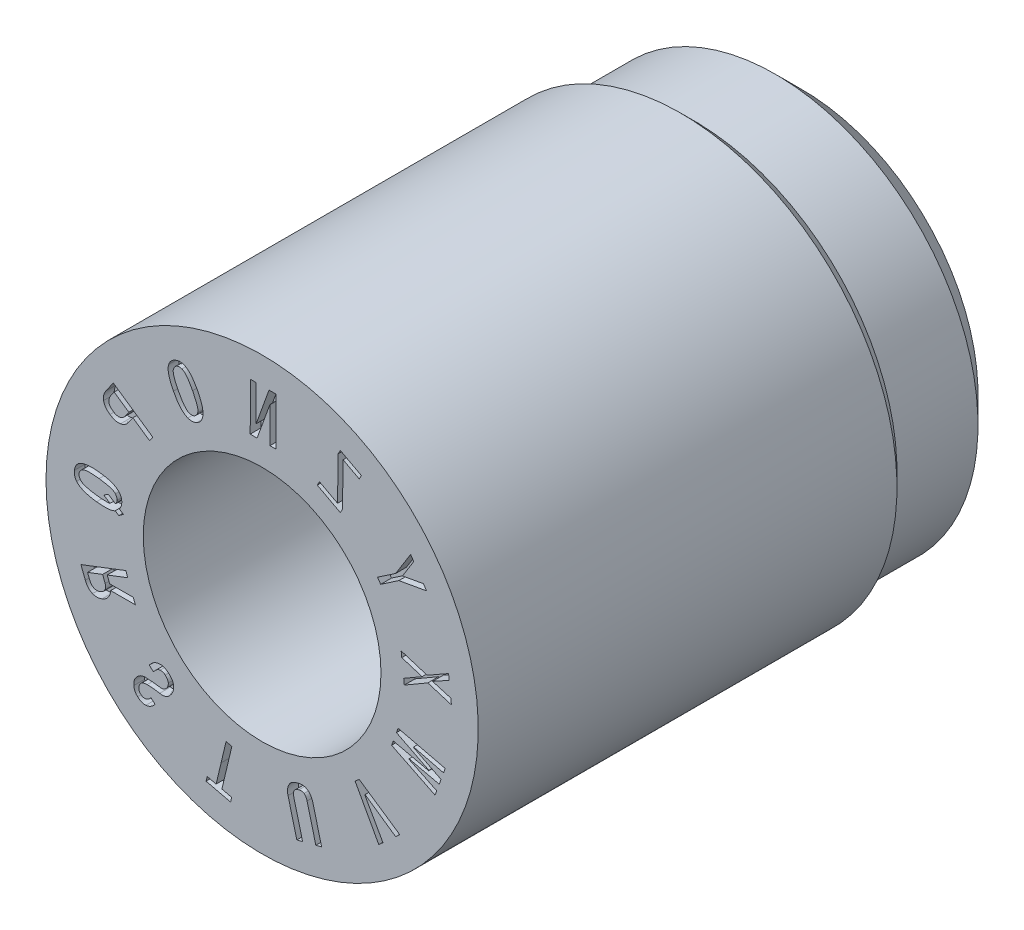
SolidWorks part; units mm, degrees
ref_plane "Front Plane" through (0, 0, 0) normal (0, 0, 1) x (1, 0, 0)
ref_plane "Top Plane" through (0, 0, 0) normal (0, 1, 0) x (1, 0, 0)
ref_plane "Right Plane" through (0, 0, 0) normal (1, 0, 0) x (0, 0, -1)
sketch "Sketch2" plane through (0, 0, 0) normal (0, 1, 0) x (1, 0, 0)
  line L0 (0, 4.8491) -> (0, -49995.1509) construction
  line L10 (3.2496, 10) -> (1.15, 10)
  line L11 (3.75, 9.4996) -> (3.2496, 10)
  line L12 (3.75, 8) -> (3.75, 9.4996)
  line L13 (4, 7.75) -> (3.75, 8)
  line L14 (4, 0) -> (4, 7.75)
  line L15 (2.2, 0) -> (4, 0)
  line L16 (2.2, 0) -> (2.2, 7.468)
  line L17 (1.15, 7.468) -> (2.2, 7.468)
  line L18 (1.15, 7.468) -> (1.15, 10)
  dimension "D1" = 8
  dimension "D2" = 4.4
  dimension "D3" = 2.532
  dimension "D4" = 2.3
  dimension "D5" = 7.5
  dimension "D6" = 10
  dimension "D7" = 45
  dimension "D8" = 45
  dimension "D9" = 2
  dimension "D10" = 0.5004
revolve "Revolve1" add sketch "Sketch2" angle 360 about L0
sketch "Sketch7" plane through (0, 0, 0) normal (0, 0, 1) x (1, 0, 0)
  line L0 (0, 0) -> (1.8589, 3.5418) construction
  line L1 (0, 0) -> (3.2919, 2.2723) construction
  line L2 (0, 0) -> (3.9708, 0.4821) construction
  line L3 (0, 0) -> (3.7401, -1.4184) construction
  line L4 (0, 0) -> (2.6525, -2.994) construction
  line L5 (0, 0) -> (0.9573, -3.8838) construction
  line L6 (0, 0) -> (-0.9573, -3.8838) construction
  line L7 (0, 0) -> (-2.6525, -2.994) construction
  line L8 (0, 0) -> (-3.7401, -1.4184) construction
  line L9 (0, 0) -> (-3.9708, 0.4821) construction
  line L10 (0, 0) -> (-3.2919, 2.2723) construction
  line L11 (0, 0) -> (-1.8589, 3.5418) construction
  line L115 (0, 0) -> (0, 4) construction
  circle A54 centre (0, 0) radius 4 construction
  circle A55 centre (0, 0) radius 2.6252 construction
  text T0 "XYZNOPQRSTUVW" font "MS Gothic" height 0.89
  point P17 (0, 0)
  dimension "D1" = 13
extrude "Cut-Extrude1" cut sketch "Sketch7" against normal blind 0.2
